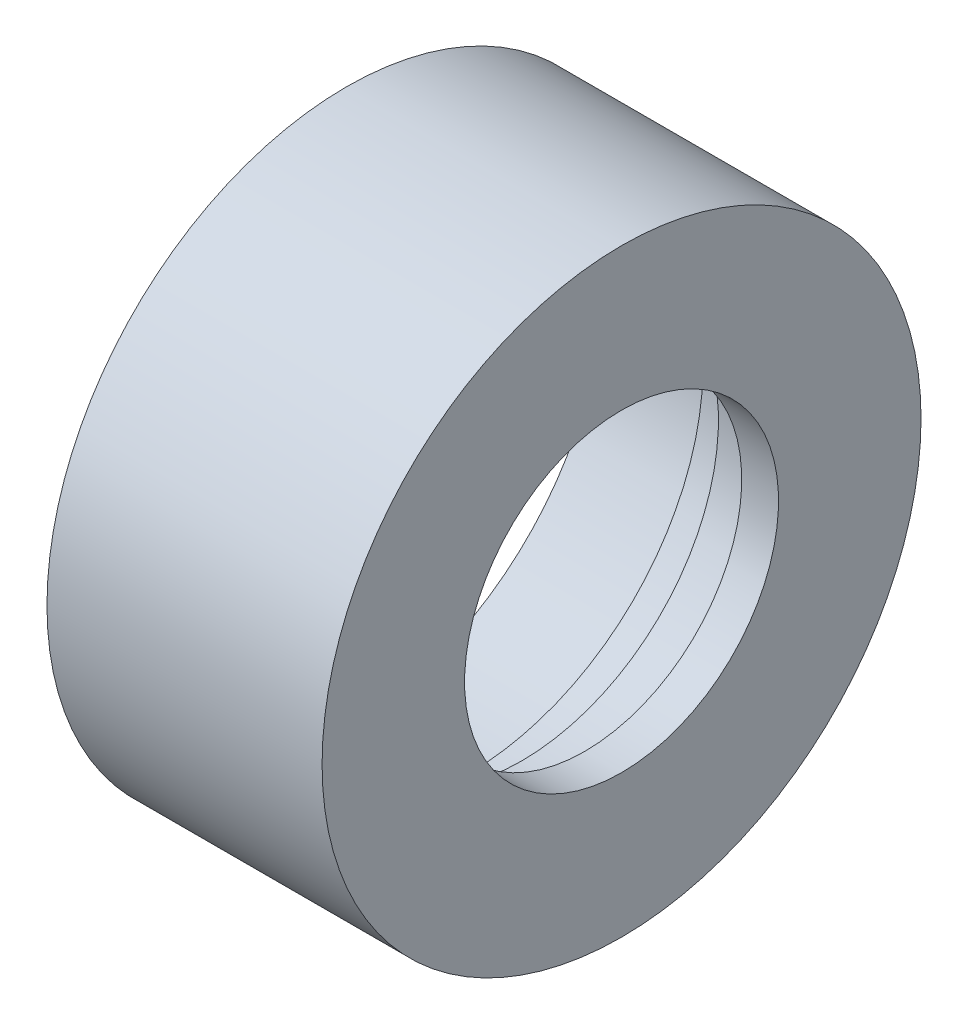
SolidWorks part; units mm, degrees
ref_plane "Front Plane" through (0, 0, 0) normal (0, 0, 1) x (1, 0, 0)
ref_plane "Top Plane" through (0, 0, 0) normal (0, 1, 0) x (1, 0, 0)
ref_plane "Right Plane" through (0, 0, 0) normal (1, 0, 0) x (0, 0, -1)
sketch "Sketch1" plane through (0, 0, 0) normal (0, 0, 1) x (1, 0, 0)
  line L0 (-15.9887, 110.6586) -> (-15.9887, 60.6586) construction
  line L1 (-15.9637, 110.6836) -> (-34.2352, 110.6836) construction
  line L2 (-15.9887, 110.6836) -> (-23.9796, 110.6836)
  line L3 (-15.9887, 110.6586) -> (-34.2352, 110.6586) construction
  line L4 (-44.5564, 85.6586) -> (5.7043, 85.6586) construction
  line L5 (-15.9637, 110.6836) -> (-15.9637, 60.6586) construction
  line L6 (-15.9637, 105.6305) -> (-11.2796, 105.6305)
  line L7 (-11.2796, 105.6305) -> (-11.2796, 123.7586)
  line L8 (-11.2796, 123.7586) -> (-46.2796, 123.7586)
  line L9 (-46.2796, 123.7586) -> (-46.2796, 118.2798)
  line L10 (-46.2796, 118.2798) -> (-30.7796, 118.2798)
  line L11 (-30.7796, 118.2798) -> (-30.7796, 115.5095)
  line L12 (-30.7796, 115.5095) -> (-23.9796, 115.5095)
  line L13 (-23.9796, 115.5095) -> (-23.9796, 110.6836)
  line L14 (-15.9887, 110.6836) -> (-15.9637, 105.6305)
  line L15 (-15.9887, 110.6836) -> (-15.9887, 110.6586)
  dimension "D2" = 76.2
  dimension "D3" = 65.2423
  dimension "D4" = 59.7018
  dimension "D5" = 50.05
  dimension "D6" = 39.9438
  dimension "D7" = 35
  dimension "D8" = 19.5
  dimension "D9" = 12.7
  dimension "D1" = 0.025
revolve "Revolve1" add sketch "Sketch1" angle 360 about L4
